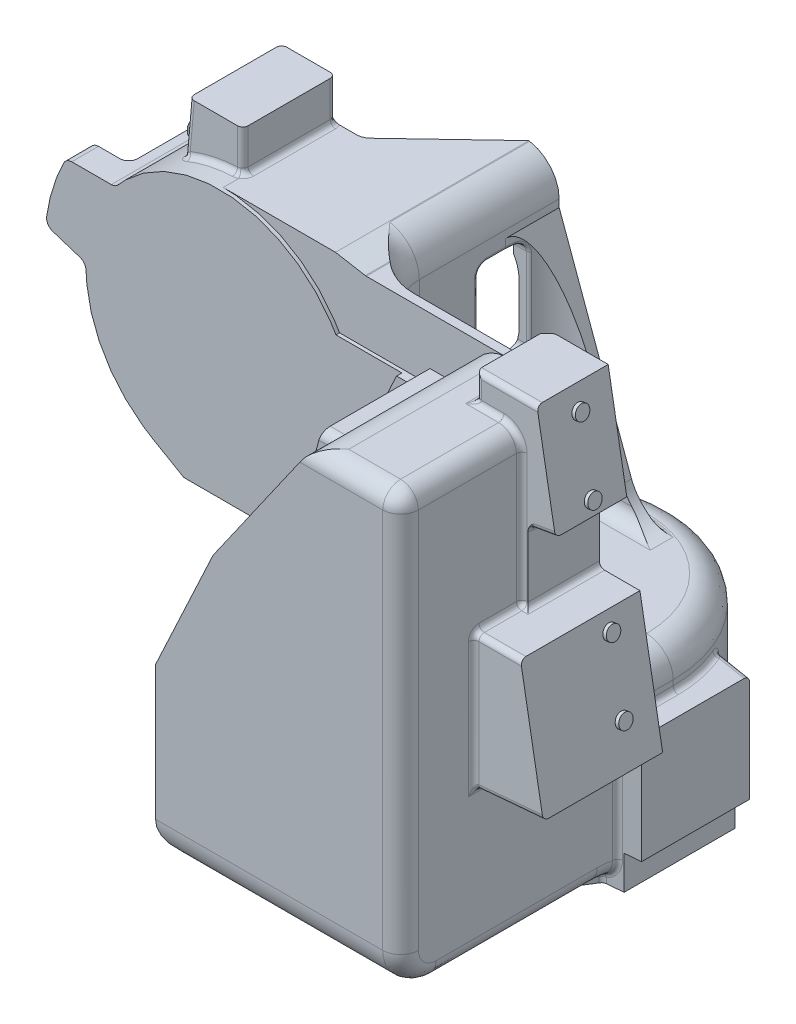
SolidWorks part; units mm, degrees
ref_plane "Ebene vorne" through (0, 0, 0) normal (0, 0, 1) x (1, 0, 0)
ref_plane "Ebene oben" through (0, 0, 0) normal (0, 1, 0) x (1, 0, 0)
ref_plane "Ebene rechts" through (0, 0, 0) normal (1, 0, 0) x (0, 0, -1)
imported_body "Oberfläche-Importiert1"
sketch "Skizze1" plane through (215.8071, 38.0526, 0) normal (-0.9848, -0.1736, 0) x (0, 0, 1)
  line L0 (63.5, 38.1598) -> (63.5, -1.8402) construction
  line L1 (63.5, -1.8402) -> (63.5, -61.8402) construction
  line L2 (63.5, -61.8402) -> (63.5, -101.8402) construction
  line L3 (63.5, 38.1598) -> (63.5, 50.7179) construction
  line L4 (82, 50.7179) -> (45, 50.7179) construction
  line L5 (109, -51.8402) -> (45, -51.8402) construction
  circle A0 centre (63.5, -101.8402) radius 4
  circle A1 centre (63.5, -61.8402) radius 4
  circle A2 centre (63.5, -1.8402) radius 4
  circle A3 centre (63.5, 38.1598) radius 4
  dimension "D5" = 8
  dimension "D1" = 10
  dimension "D2" = 40
  dimension "D3" = 40
  dimension "D4" = 100
extrude "Aufsatz-Linear austragen1" add sketch "Skizze1" against normal blind 2
